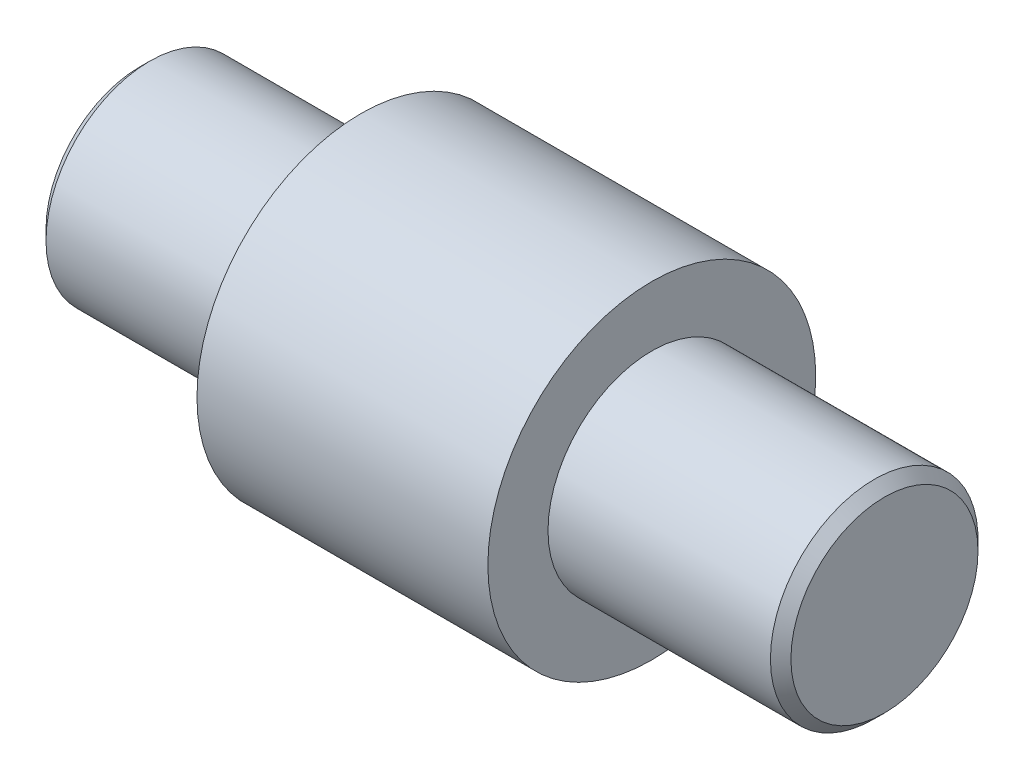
SolidWorks part; units mm, degrees
ref_plane "Plan de face" through (0, 0, 0) normal (0, 0, 1) x (1, 0, 0)
ref_plane "Plan de dessus" through (0, 0, 0) normal (0, 1, 0) x (1, 0, 0)
ref_plane "Plan de droite" through (0, 0, 0) normal (1, 0, 0) x (0, 0, -1)
sketch "Esquisse1" plane through (0, 0, 0) normal (0, 0, 1) x (1, 0, 0)
  line L1 (53.607, -119.9853) -> (82, -119.9853)
  line L2 (32, -125.8548) -> (32, -135.9853)
  line L3 (32, -135.9853) -> (82, -135.9853)
  line L4 (82, -119.9853) -> (82, -125.8548)
  line L7 (82, -135.9853) -> (104.7092, -135.9853)
  line L8 (45.7932, -135.9853) -> (92.6314, -135.9853) construction
  line L9 (82, -125.8548) -> (104.7092, -125.8548)
  line L10 (104.7092, -135.9853) -> (104.7092, -125.8548)
  line L11 (53.607, -125.8548) -> (32, -125.8548)
  line L12 (53.607, -119.9853) -> (53.607, -125.8548)
  dimension "D1" = 16
  dimension "D2" = 10.1304
revolve "Révolution1" add sketch "Esquisse1" angle 360 about L8
chamfer "Chanfrein1" distance 1 angle 45 2 edges at (104.7092, -135.9853, 10.1304) (32, -135.9853, 10.1304)
